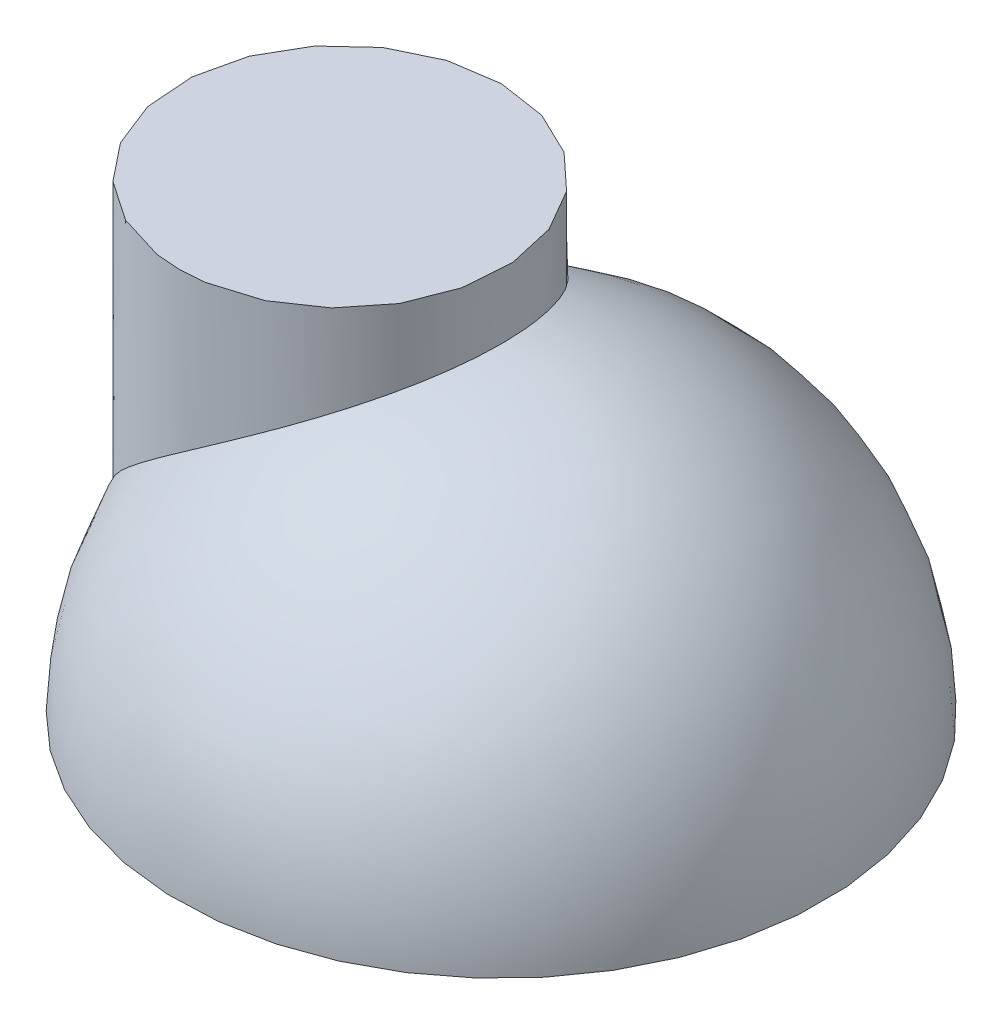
SolidWorks part; units mm, degrees
ref_plane "前视" through (0, 0, 0) normal (0, 0, 1) x (1, 0, 0)
ref_plane "上视" through (0, 0, 0) normal (0, 1, 0) x (1, 0, 0)
ref_plane "右视" through (0, 0, 0) normal (1, 0, 0) x (0, 0, -1)
sketch "草图1" plane through (0, 0, 0) normal (0, 0, 1) x (1, 0, 0)
  line L0 (-30, 0) -> (0, 0)
  line L1 (0, 0) -> (0, 30)
  line L2 (0, 0) -> (0, -22.3118) construction
  arc A0 (-30, 0) -> (0, 30) centre (0, 0) cw
  dimension "D1" = 60
revolve "旋转1" add sketch "草图1" angle 360 about L2
sketch "草图2" plane through (0, 0, 0) normal (0, 1, 0) x (1, 0, 0)
  circle A0 centre (-15, 0) radius 15
  circle A1 centre (0, 0) radius 30 construction
extrude "拉伸1" add sketch "草图2" along normal blind 36
